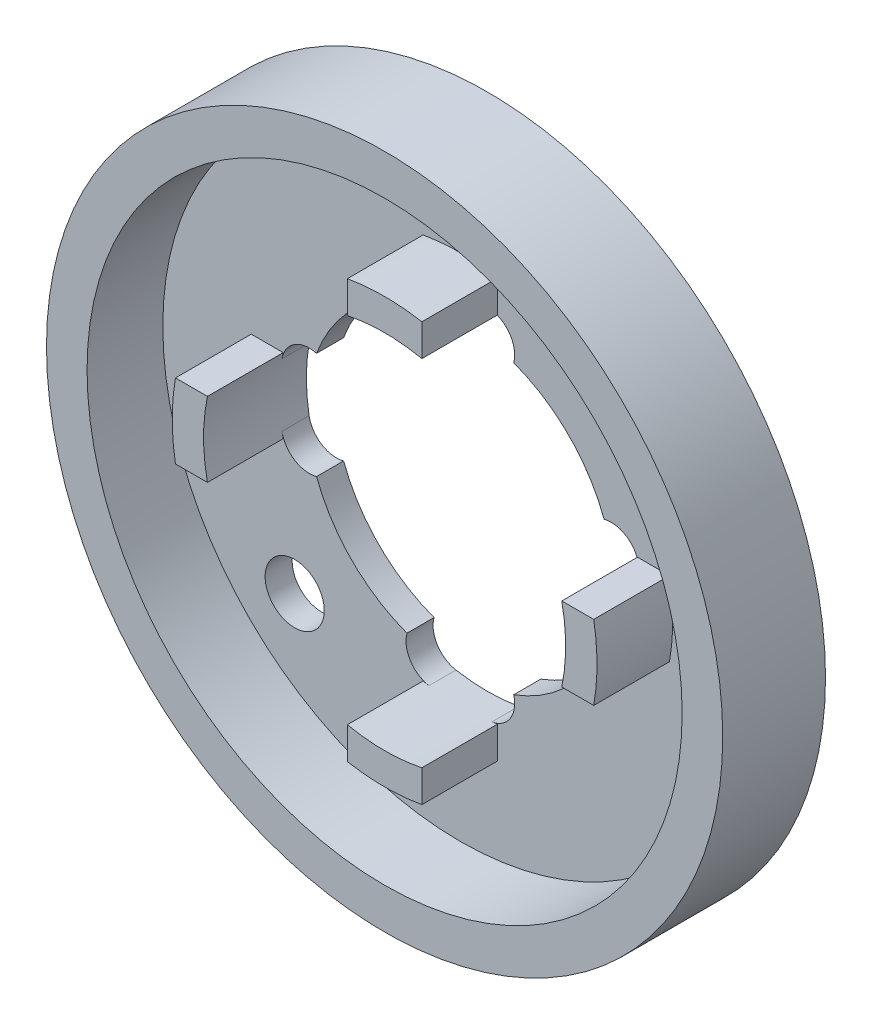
SolidWorks part; units mm, degrees
ref_plane "Front Plane" through (0, 0, 0) normal (0, 0, 1) x (1, 0, 0)
ref_plane "Top Plane" through (0, 0, 0) normal (0, 1, 0) x (1, 0, 0)
ref_plane "Right Plane" through (0, 0, 0) normal (1, 0, 0) x (0, 0, -1)
sketch "Sketch1" plane through (0, 0, 0) normal (0, 0, 1) x (1, 0, 0)
  circle A0 centre (0, 0) radius 15.875
  dimension "D1" = 31.75
extrude "Boss-Extrude1" add sketch "Sketch1" along normal blind 4.826
sketch "Sketch3" plane through (0, 0, 4.826) normal (0, 0, 1) x (1, 0, 0)
  circle A0 centre (0, 0) radius 7.2
  dimension "D1" = 14.4
extrude "Cut-Extrude1" cut sketch "Sketch3" against normal up to next
sketch "Sketch4" plane through (0, 0, 0) normal (0, 1, 0) x (1, 0, 0)
  line L0 (0, 0) -> (0, -50000) construction
  line L2 (-7, -1.27) -> (-13.97, -1.27)
  line L3 (-13.97, -1.27) -> (-13.97, -4.826)
  line L4 (-15.875, -4.826) -> (15.875, -4.826) construction
  line L5 (-13.97, -4.826) -> (-7, -4.826)
  line L6 (-7.2, -4.826) -> (7.2, -4.826) construction
  line L7 (-7, -4.826) -> (-7, -1.27)
  line L8 (15.875, 0) -> (-15.875, 0) construction
  dimension "D2" = 1.27
  dimension "D3" = 13.97
  dimension "D5" = 7
revolve "Cut-Revolve1" cut sketch "Sketch4" angle 360 about L0
sketch "Sketch5" plane through (0, 0, 0) normal (0, 1, 0) x (1, 0, 0)
  line L0 (0, -5.8136) -> (0, 0) construction
  line L1 (-13.97, -4.826) -> (13.97, -4.826) construction
  arc A0 (-7.5, -3.826) -> (7.5, -3.826) centre (0, 9.3304) ccw
  dimension "D1" = 15.144
  dimension "D2" = 7.5
  dimension "D3" = 1
ref_plane "Plane1" through (0, 0, 5.8136) normal (0, 0, 1) x (1, 0, 0)
sketch "Sketch6" plane through (0, 0, 1.27) normal (0, 0, 1) x (1, 0, 0)
  line L0 (0, 0) -> (-50000, 0) construction
  line L1 (-8.3179, 1.75) -> (-9.8179, 1.75)
  line L2 (-8.3179, -1.75) -> (-9.8179, -1.75)
  arc A0 (-8.3179, 1.75) -> (-8.3179, -1.75) centre (0, 0) ccw
  arc A1 (-9.8179, 1.75) -> (-9.8179, -1.75) centre (0, 0) ccw
  dimension "D1" = 3.5
  dimension "D2" = 8.5
  dimension "D3" = 1.5
extrude "Boss-Extrude2" add sketch "Sketch6" along normal up to surface (3.556 mm away)
sketch "Sketch7" plane through (0, 0, 1.27) normal (0, 0, 1) x (1, 0, 0)
  line L0 (0, 0) -> (-7.2, 0) construction
  line L1 (-7.0906, 1.2503) -> (0, 0) construction
  line L2 (0, 0) -> (-7.0906, -1.2503) construction
  arc A0 (-7.0906, -1.2503) -> (-7.0906, 1.2503) centre (0, 0) cw construction
  circle A1 centre (0, 0) radius 7.2 construction
  arc A2 (-8.3709, 1.476) -> (-8.3709, -1.476) centre (0, 0) ccw
  arc A3 (-5.8104, 1.0245) -> (-5.8104, -1.0245) centre (0, 0) ccw
  arc A4 (-5.8104, 1.0245) -> (-8.3709, 1.476) centre (-7.0906, 1.2503) ccw
  arc A5 (-8.3709, -1.476) -> (-5.8104, -1.0245) centre (-7.0906, -1.2503) ccw
  arc A6 (-8.3179, 1.75) -> (-8.3179, -1.75) centre (0, 0) ccw construction
  point P6 (-7.2, 0)
  dimension "D1" = 20
extrude "Cut-Extrude2" cut sketch "Sketch7" against normal up to next
pattern_circular "CirPattern1" count 4 over 360 about axis through (0, 0, 0) along (0, 0, 1) of "Boss-Extrude2", "Cut-Extrude2"
hole_wizard "7/64 (0.10938) Diameter Hole1" positions "Sketch9" profile "Sketch8" hole size "7/64" standard "ANSI Inch"
sketch "Sketch9" plane through (0, 0, 0) normal (0, 0, -1) x (-1, 0, 0)
  line L0 (-7.7782, 7.7782) -> (7.7782, -7.7782) construction
  line L2 (0, 0) -> (-4.4765, 0) construction
  point P0 (7.7782, -7.7782)
  point P2 (-7.7782, 7.7782)
  dimension "D1" = 45
  dimension "D2" = 22
sketch "Sketch8" plane through (-7.7782, -7.7782, 0) normal (1, 0, 0) x (0, 1, 0)
  line L0 (0, 0) -> (0, 4.826)
  line L1 (0, 4.826) -> (1.3891, 4.826)
  line L2 (1.3891, 4.826) -> (1.3891, 0)
  line L5 (1.3891, 0) -> (0, 0)
  line L11 (0, -6.35) -> (0, 107.95) construction
  dimension "Thru Hole Dia." = 2.7783
  dimension "Thru Hole Depth" = 4.826
